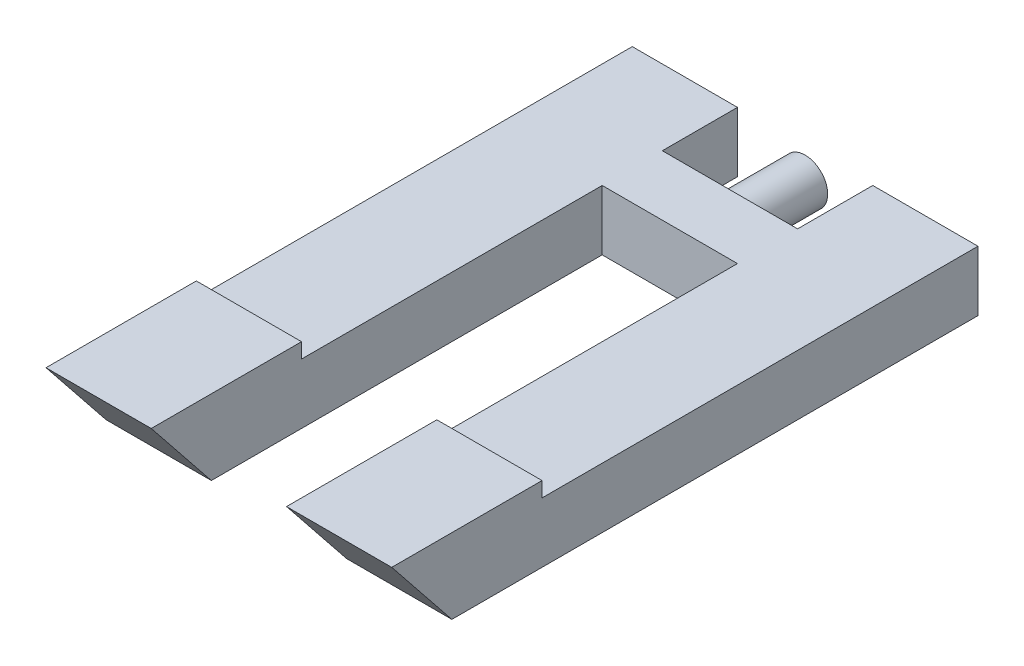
SolidWorks part; units mm, degrees
ref_plane "Front Plane" through (0, 0, 0) normal (0, 0, 1) x (1, 0, 0)
ref_plane "Top Plane" through (0, 0, 0) normal (0, 1, 0) x (1, 0, 0)
ref_plane "Right Plane" through (0, 0, 0) normal (1, 0, 0) x (0, 0, -1)
sketch "Sketch1" plane through (0, 0, 0) normal (0, 1, 0) x (1, 0, 0)
  line L2 (-4.5, 0) -> (-4.5, 5)
  line L3 (-4.5, 5) -> (-11.5, 5)
  line L4 (-11.5, 5) -> (-11.5, -30)
  line L5 (-11.5, -30) -> (-4.5, -30)
  line L6 (-4.5, -30) -> (-4.5, -4)
  line L7 (0, 0) -> (0, -4)
  line L9 (-4.5, 0) -> (0, 0)
  line L11 (-4.5, -4) -> (0, -4)
  dimension "D1" = 4.5
  dimension "D2" = 7
  dimension "D3" = 35
  dimension "D4" = 5
  dimension "D5" = 4
extrude "Boss-Extrude1" add sketch "Sketch1" along normal mid plane 4
sketch "Sketch5" plane through (-11.5, 0, 0) normal (-1, 0, 0) x (0, 0, 1)
  line L0 (30, 2) -> (24, 2)
  line L1 (-5, 2) -> (30, 2) construction
  line L2 (24, 2) -> (24, 3)
  line L3 (24, 3) -> (34, 3)
  line L4 (34, 3) -> (30, -2)
  line L5 (30, -2) -> (30, 2)
  line L6 (-5, -2) -> (30, -2) construction
  dimension "D1" = 10
  dimension "D2" = 4
  dimension "D3" = 5
extrude "Boss-Extrude4" add sketch "Sketch5" against normal up to surface (7 mm away)
mirror "Mirror1" about plane through (0, 2, 0) normal (-1, 0, 0)
sketch "Sketch3" plane through (0, 0, 0) normal (0, 0, -1) x (-1, 0, 0)
  circle A0 centre (0, 0) radius 1.5
  dimension "D1" = 3
extrude "Boss-Extrude2" add sketch "Sketch3" along normal blind 5
